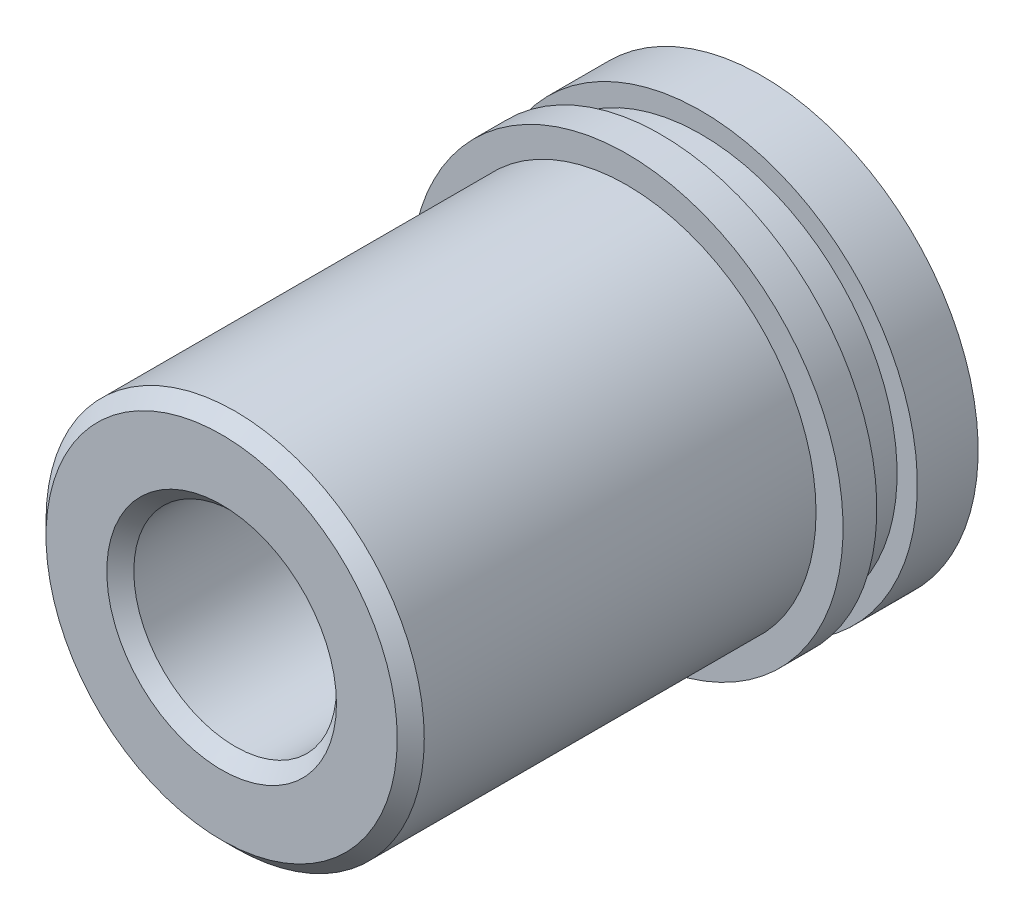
SolidWorks part; units mm, degrees
ref_plane "XY" through (0, 0, 0) normal (0, 0, 1) x (1, 0, 0)
ref_plane "XZ" through (0, 0, 0) normal (0, 1, 0) x (1, 0, 0)
ref_plane "YZ" through (0, 0, 0) normal (1, 0, 0) x (0, 0, -1)
sketch "Esquisse1" plane through (0, 0, 0) normal (0, 1, 0) x (1, 0, 0)
  line L0 (0, 19.9571) -> (0, -36.5881) construction
  line L1 (-7.5, 10) -> (-16, 10)
  line L2 (-16, 10) -> (-16, 5.5)
  line L3 (-16, 5.5) -> (-14.5, 5.5)
  line L4 (-14.5, 5.5) -> (-14.5, 2.5)
  line L5 (-14.5, 2.5) -> (-16, 2.5)
  line L6 (-16, 2.5) -> (-16, 0)
  line L7 (-16, 0) -> (-14, 0)
  line L8 (-14, 0) -> (-14, -30)
  line L9 (-14, -30) -> (-7.5, -30)
  line L10 (-7.5, -30) -> (-7.5, 10)
  dimension "D1" = 32
  dimension "D2" = 28
  dimension "D3" = 15
  dimension "D4" = 29
  dimension "D5" = 10
  dimension "D6" = 3
  dimension "D7" = 2.5
  dimension "D8" = 30
revolve "Bague" add sketch "Esquisse1" angle 360 about L0
chamfer "Chanf 1" distance 1 angle 45
